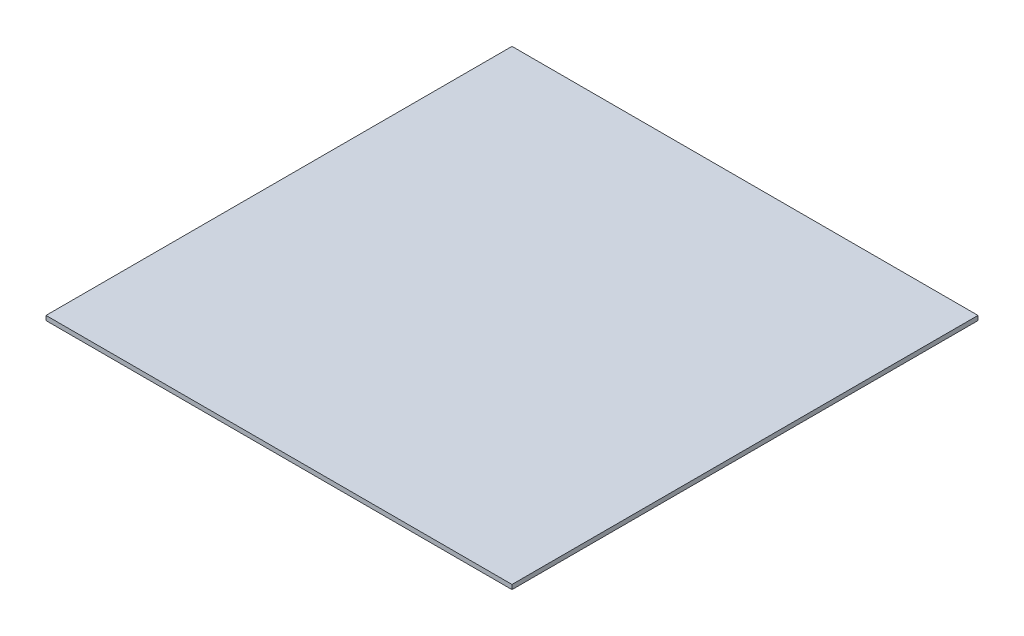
SolidWorks part; units mm, degrees
ref_plane "Ebene vorne" through (0, 0, 0) normal (0, 0, 1) x (1, 0, 0)
ref_plane "Ebene oben" through (0, 0, 0) normal (0, 1, 0) x (1, 0, 0)
ref_plane "Ebene rechts" through (0, 0, 0) normal (1, 0, 0) x (0, 0, -1)
sketch "Skizze1" plane through (0, 0, 0) normal (0, 1, 0) x (1, 0, 0)
  line L1 (-155, -155) -> (155, -155)
  line L2 (-155, -155) -> (-155, 155)
  line L3 (-155, 155) -> (155, 155)
  line L4 (155, -155) -> (155, 155)
  line L5 (-155, -155) -> (155, 155) construction
  line L6 (-155, 155) -> (155, -155) construction
  point P0 (0, 0)
  dimension "D1" = 310
  dimension "D2" = 310
extrude "Aufsatz-Linear austragen1" add sketch "Skizze1" along normal blind 3
